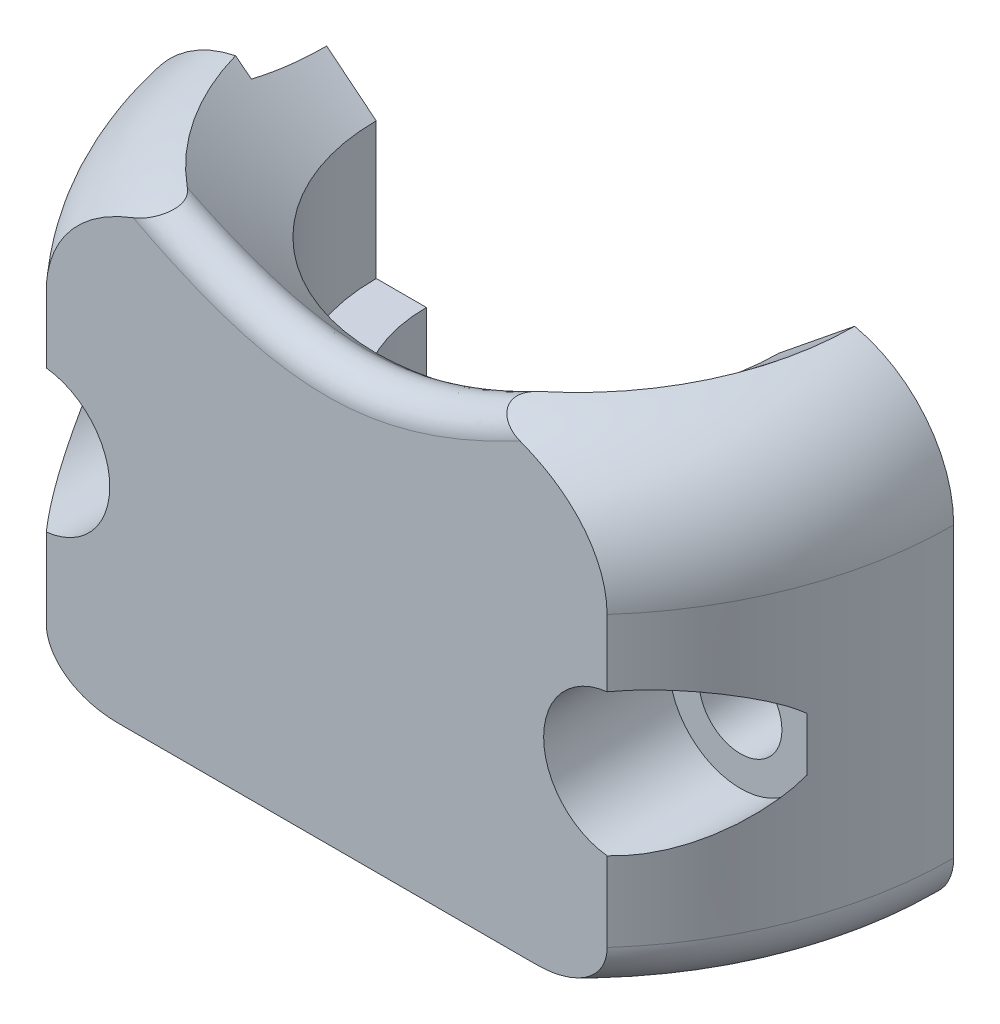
SolidWorks part; units mm, degrees
ref_plane "Спереди" through (0, 0, 0) normal (0, 0, 1) x (1, 0, 0)
ref_plane "Сверху" through (0, 0, 0) normal (0, 1, 0) x (1, 0, 0)
ref_plane "Справа" through (0, 0, 0) normal (1, 0, 0) x (0, 0, -1)
sketch "Эскиз1" plane through (0, 0, 0) normal (0, 0, 1) x (1, 0, 0)
  line L0 (0, 27.7493) -> (0, 0) construction
  line L1 (0, 0) -> (22.712, 0) construction
  line L4 (8.025, 0) -> (8.025, 5)
  line L5 (15, 18.5) -> (15, 0)
  line L6 (15, 18.5) -> (8.025, 18.5)
  line L7 (15, 0) -> (8.025, 0)
  line L8 (8.025, 18.5) -> (8.025, 10.5)
  line L9 (8.025, 10.5) -> (6.025, 10.5)
  line L10 (6.025, 10.5) -> (6.025, 5)
  line L11 (6.025, 5) -> (8.025, 5)
  dimension "D1" = 16.05
  dimension "D2" = 8
  dimension "D3" = 12.05
  dimension "D4" = 5.5
  dimension "D5" = 18.5
  dimension "D6" = 30
revolve "Повернуть1" add sketch "Эскиз1" angle 180 about L0
fillet "Скругление1" radius 5 1 edges at (0, 18.5, 15)
fillet "Скругление2" radius 2 1 edges at (0, 0, 15)
sketch "Эскиз2" plane through (0, 0, 0) normal (0, 0, -1) x (-1, 0, 0)
  line L0 (0, 0) -> (0, 18.2161) construction
  line L1 (0, 0) -> (19.1417, 0) construction
  circle A0 centre (11.5, 8) radius 1.65
  circle A1 centre (-11.5, 8) radius 1.65
  dimension "D1" = 23
  dimension "D2" = 3.3
  dimension "D3" = 8
extrude "Вырез-Вытянуть1" cut sketch "Эскиз2" against normal through all
ref_plane "Плоскость1" through (0, 0, 15) normal (0, 0, 1) x (1, 0, 0)
sketch "Эскиз3" plane through (0, 0, 15) normal (0, 0, 1) x (1, 0, 0)
  circle A0 centre (-11.5, 8) radius 2.85
  circle A1 centre (11.5, 8) radius 2.85
  dimension "D1" = 5.7
extrude "Вырез-Вытянуть2" cut sketch "Эскиз3" against normal blind 10
sketch "Эскиз5" plane through (0, 18.5, 0) normal (0, 1, 0) x (1, 0, 0)
  line L0 (0, 0) -> (0, -17.2641) construction
  line L2 (-11.1803, -15) -> (11.1803, -15)
  line L3 (-11.1803, -15) -> (-11.1803, -10)
  line L4 (-11.1803, -10) -> (11.1803, -10)
  line L5 (11.1803, -15) -> (11.1803, -10)
  arc A0 (-15, 0) -> (15, 0) centre (0, 0) ccw construction
  dimension "D1" = 5
extrude "Вырез-Вытянуть4" cut sketch "Эскиз5" against normal through all
sketch "Эскиз4" plane through (0, 0, 0) normal (0, 0, -1) x (-1, 0, 0)
  line L0 (0, 0) -> (0, 23.303) construction
  line L1 (0, 0) -> (24.0065, 0) construction
  line L2 (10, 18.5) -> (10, 15.1261)
  arc A0 (10, 15.1261) -> (15, 13.5) centre (15, 22) ccw
  arc A1 (15, 13.5) -> (10, 18.5) centre (10, 13.5) ccw construction
  arc A2 (15, 13.5) -> (10, 18.5) centre (10, 13.5) ccw
  dimension "D1" = 15
  dimension "D3" = 22
chamfer "Фаска1" distance 2.5 angle 45 1 edges at (0, 18.5, 8.025)
extrude "Вырез-Вытянуть5" cut sketch "Эскиз4" against normal blind 3
fillet "Скругление3" radius 1 1 edges at (-0.515, 17.5508, 10)
